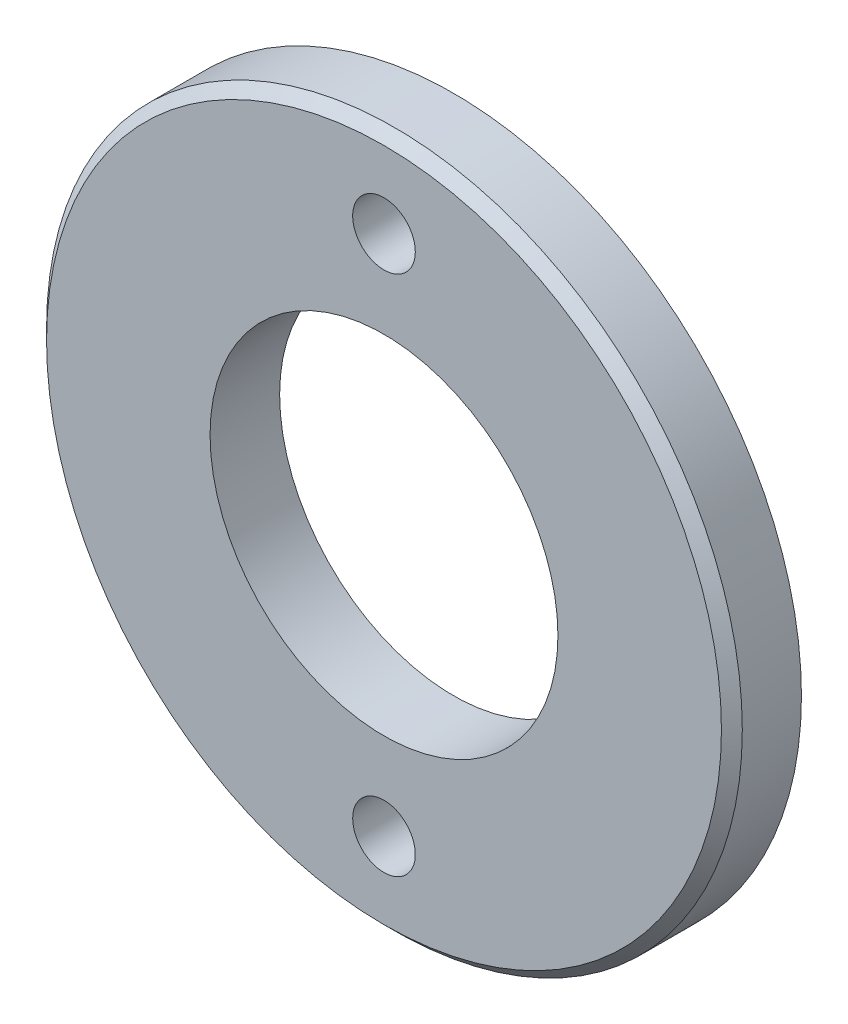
SolidWorks part; units mm, degrees
ref_plane "Front/Back" through (0, 0, 0) normal (0, 0, 1) x (1, 0, 0)
ref_plane "Top/Bottom" through (0, 0, 0) normal (0, 1, 0) x (1, 0, 0)
ref_plane "Right/Left" through (0, 0, 0) normal (1, 0, 0) x (0, 0, -1)
sketch "Sketch1" plane through (0, 0, 0) normal (0, 0, 1) x (1, 0, 0)
  circle A0 centre (0, 0) radius 25.4
  dimension "D1" = 50.8
extrude "Extrude1" add sketch "Sketch1" along normal mid plane 5.08
sketch "Sketch2" plane through (0, 0, 2.54) normal (0, 0, 1) x (1, 0, 0)
  circle A0 centre (0, 0) radius 12.7
  dimension "D1" = 25.4
extrude "Cut-Extrude1" cut sketch "Sketch2" against normal through all
sketch "Sketch3" plane through (0, 0, 2.54) normal (0, 0, 1) x (1, 0, 0)
  line L0 (0, 0) -> (31.5169, 0) construction
  line L1 (0, 0) -> (0, 27.2339) construction
  circle A0 centre (0, 19.05) radius 2.286
  circle A1 centre (0, 0) radius 19.05 construction
  dimension "D1" = 4.572
  dimension "D2" = 38.1
extrude "Cut-Extrude2" cut sketch "Sketch3" against normal through all
pattern_circular "CirPattern1" count 2 every 180 about axis through (0, 0, 0) along (0, 0, 1) of "Cut-Extrude2"
chamfer "Chamfer1" distance 0.762 angle 45 1 edges at (25.4, 0, 2.54)
